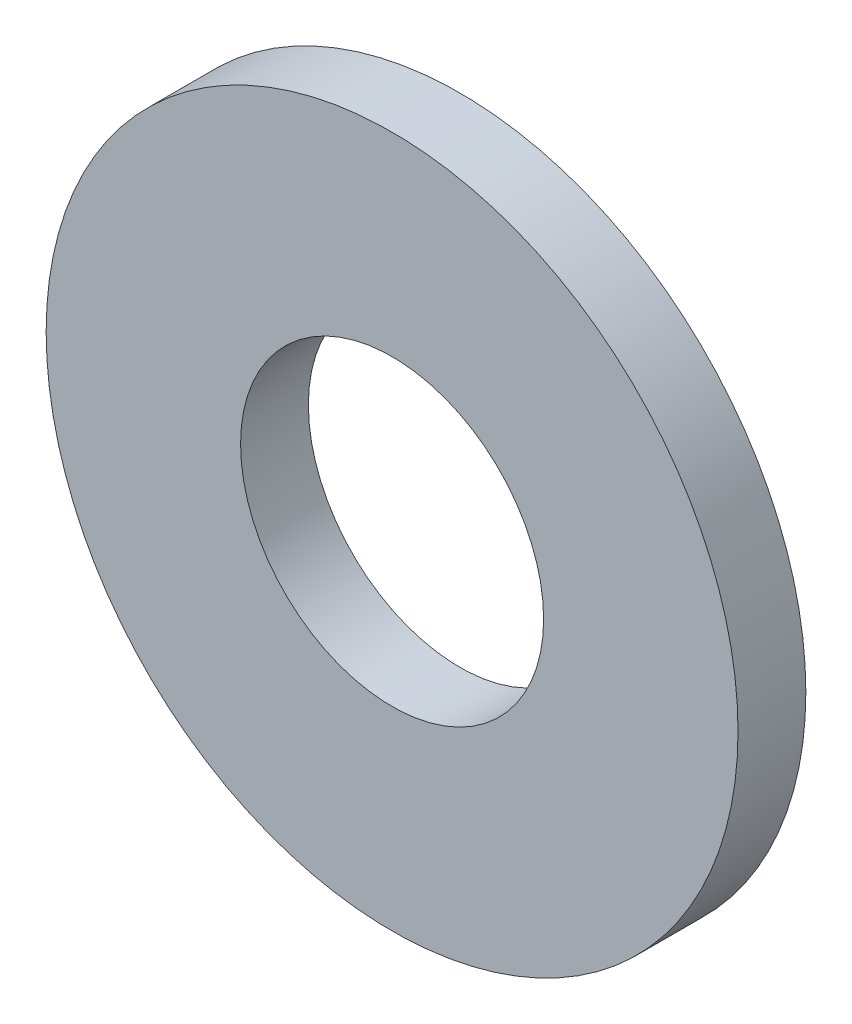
SolidWorks part; units mm, degrees
ref_plane "Front X-Y" through (0, 0, 0) normal (0, 0, 1) x (1, 0, 0)
ref_plane "Top X-Z" through (0, 0, 0) normal (0, 1, 0) x (1, 0, 0)
ref_plane "Right Y-Z" through (0, 0, 0) normal (1, 0, 0) x (0, 0, -1)
sketch "Washer Sketch" plane through (0, 0, 0) normal (0, 0, 1) x (1, 0, 0)
  circle A0 centre (0, 0) radius 2.7813
  circle A1 centre (0, 0) radius 6.35
  dimension "ID" = 5.5626
  dimension "OD" = 12.7
extrude " Washer Base-Extrude" add sketch "Washer Sketch" along normal blind 1.2446
